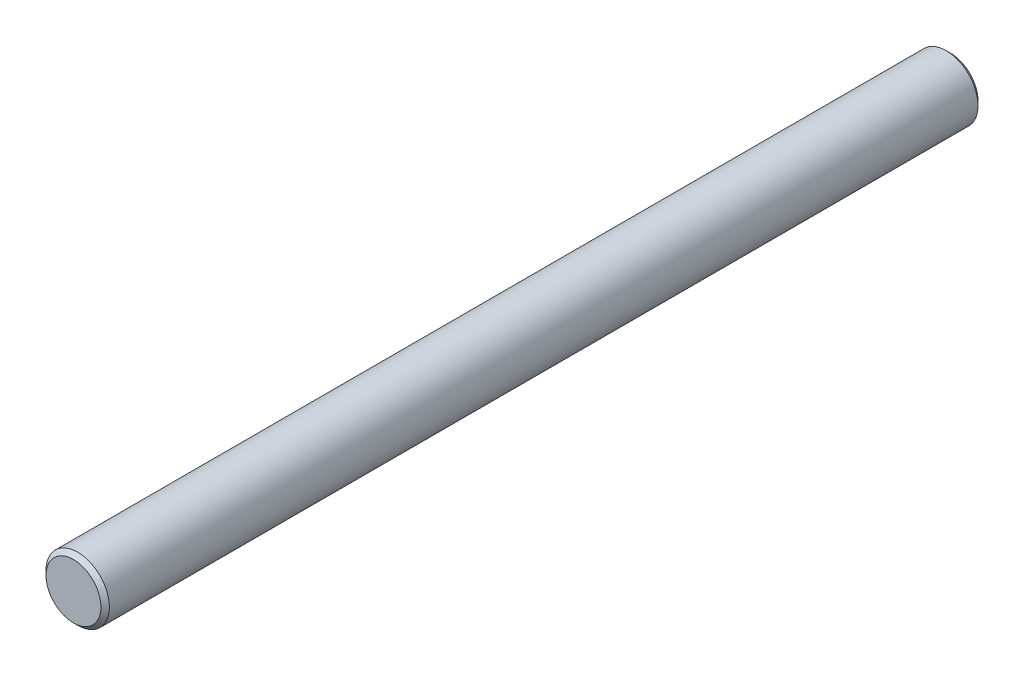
SolidWorks part; units mm, degrees
ref_plane "Face" through (0, 0, 0) normal (0, 0, 1) x (1, 0, 0)
ref_plane "Dessus" through (0, 0, 0) normal (0, 1, 0) x (1, 0, 0)
ref_plane "Droite" through (0, 0, 0) normal (1, 0, 0) x (0, 0, -1)
sketch "Esquisse1" plane through (0, 0, 0) normal (0, 0, 1) x (1, 0, 0)
  circle A0 centre (0, 0) radius 1.5
  dimension "D1" = 3
extrude "Cylindre de base" add sketch "Esquisse1" along normal mid plane 41.5
chamfer "Chanfrein1" distance 0.2 angle 45
